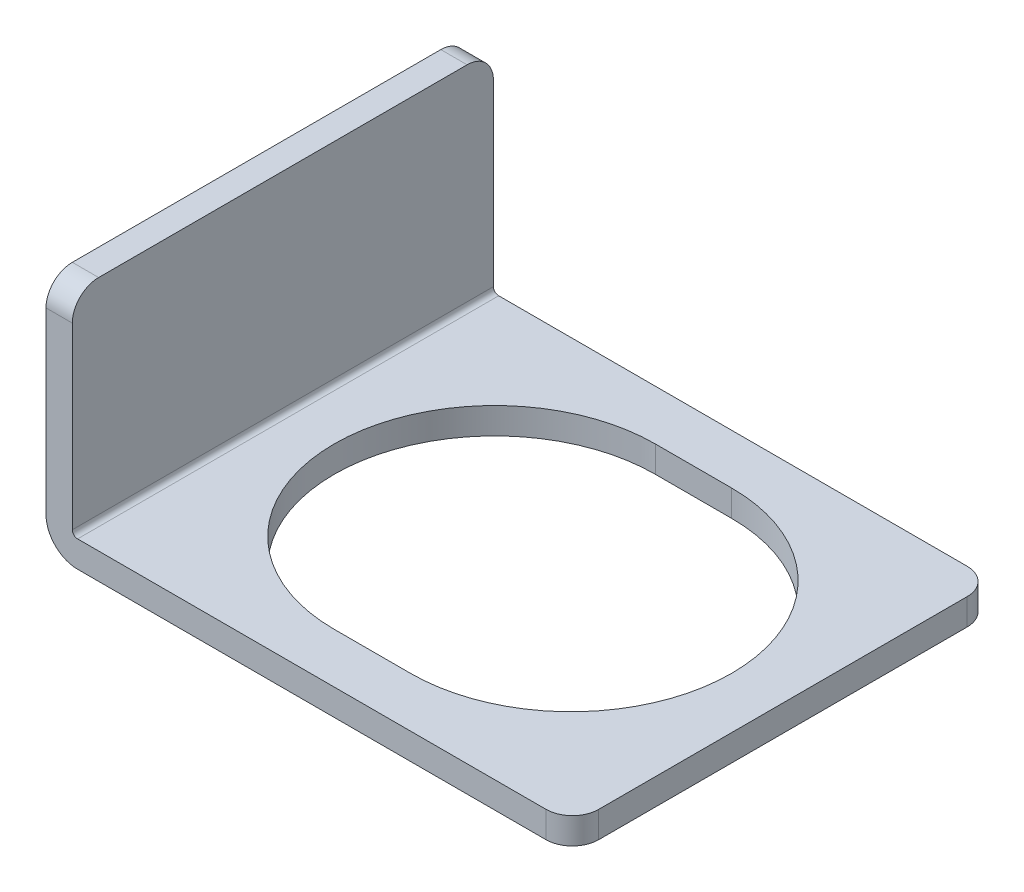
SolidWorks part; units mm, degrees
ref_plane "Front Plane" through (0, 0, 0) normal (0, 0, 1) x (1, 0, 0)
ref_plane "Top Plane" through (0, 0, 0) normal (0, 1, 0) x (1, 0, 0)
ref_plane "Right Plane" through (0, 0, 0) normal (1, 0, 0) x (0, 0, -1)
sketch "Sketch1" plane through (0, 0, 0) normal (0, 0, 1) x (1, 0, 0)
  line L0 (0, 1.2) -> (0, 9)
  line L1 (1.2, 0) -> (20, 0)
  line L2 (1.2, 1) -> (20, 1)
  line L3 (1, 1.2) -> (1, 9)
  line L4 (20, 1) -> (20, 0)
  line L5 (0, 9) -> (1, 9)
  arc A0 (1.2, 0) -> (0, 1.2) centre (1.2, 1.2) cw
  arc A1 (1.2, 1) -> (1, 1.2) centre (1.2, 1.2) cw
  point P6 (0, 0)
  dimension "D3" = 1.2
  dimension "D1" = 9
  dimension "D2" = 20
  dimension "D4" = 1
extrude "Boss-Extrude1" add sketch "Sketch1" along normal mid plane 16
sketch "Sketch2" plane through (0, 1, 0) normal (0, 1, 0) x (1, 0, 0)
  line L0 (9.05, 0) -> (11.95, 0) construction
  line L1 (9.05, 6.1) -> (11.95, 6.1)
  line L2 (9.05, -6.1) -> (11.95, -6.1)
  arc A0 (9.05, 6.1) -> (9.05, -6.1) centre (9.05, 0) ccw
  arc A1 (11.95, -6.1) -> (11.95, 6.1) centre (11.95, 0) ccw
  point P2 (10.5, 0)
  dimension "D1" = 10.5
  dimension "D2" = 12.2
  dimension "D3" = 2.9
extrude "Cut-Extrude1" cut sketch "Sketch2" against normal through all
fillet "Fillet1" radius 1 4 edges at (0.5, 9, -8) (20, 0.5, -8) (20, 0.5, 8) (0.5, 9, 8)
